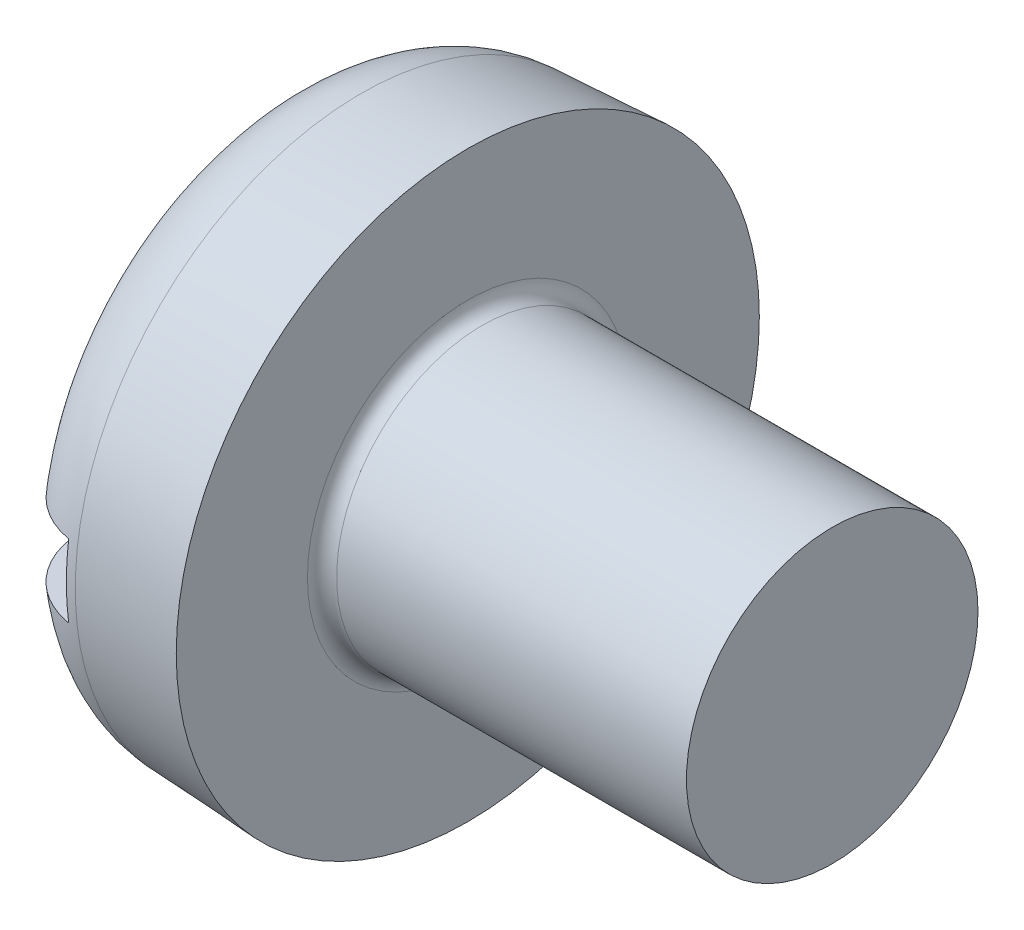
SolidWorks part; units mm, degrees
ref_plane "Front" through (0, 0, 0) normal (0, 0, 1) x (1, 0, 0)
ref_plane "Top" through (0, 0, 0) normal (0, 1, 0) x (1, 0, 0)
ref_plane "Right" through (0, 0, 0) normal (1, 0, 0) x (0, 0, -1)
ref_plane "Plane1" through (1.3, 0, 0) normal (1, 0, 0) x (0, 0, -1)
sketch "Sketch1" plane through (1.3, 0, 0) normal (1, 0, 0) x (0, 0, -1)
  circle A0 centre (0, 0) radius 2
  dimension "dk" = 4
extrude "BaseHead" add sketch "Sketch1" against normal blind 1.3 draft 3
sketch "Sketch2" plane through (1.3, 0, 0) normal (1, 0, 0) x (0, 0, -1)
  line L0 (0, 0) -> (0.8, 0) construction
  circle A0 centre (0, 0) radius 1
  dimension "d" = 2
  dimension "a" = 0.8
extrude "BaseBody" add sketch "Sketch2" along normal blind 2.5
fillet "HeadFillet2" radius 0.6 1 edges at (0, 0, -1.9319)
sketch "Sketch3" plane through (1.05, -1.05, 0) normal (0, 0, 1) x (0, -1, 0)
  line L1 (-1.3, -0.55) -> (-0.8, -0.55)
  line L2 (-1.3, -0.55) -> (-1.3, -1.05)
  line L3 (-1.3, -1.05) -> (-0.8, -1.05)
  line L4 (-0.8, -0.55) -> (-0.8, -1.05)
  line L5 (-2.4125, -1.05) -> (0.3125, -1.05) construction
  dimension "n" = 0.5
  dimension "m" = 0.25
  dimension "t" = 0.5
extrude "Notch" cut sketch "Sketch3" against normal through all and the other way through all
fillet "HeadFillet1" radius 0.1 1 edges at (1.3, 0, -1)
sketch "Sketch4" plane through (0, 0, 0) normal (0, 0, 1) x (1, 0, 0)
  line L0 (-34.7, 5.7835) -> (-34.7, 1)
  line L1 (1.3, 5.7835) -> (-34.7, 5.7835)
  line L2 (1.3, 5.7835) -> (1.3, 0.7835)
  line L3 (1.3, 0.7835) -> (-37.9, 0.7835)
  line L6 (6.4188, 0) -> (-0.5067, 0) construction
  line L8 (3.8, -1) -> (3.8, 1) construction
  line L9 (-34.7, 1) -> (-37.9, 0.7835)
  line L11 (1.3, -2) -> (1.3, 2) construction
  line L12 (3.8, 1) -> (1.4, 1) construction
  dimension "dd" = 5
  dimension "b1" = 1.567
  dimension "b" = 38.5
  dimension "x" = 3.2
sketch "Sketch5" plane through (0, 0, 0) normal (0, 0, 1) x (1, 0, 0)
  line L0 (3.8, 0.8125) -> (3.9083, 1)
  line L1 (3.9083, 1) -> (3.9083, 1.2165)
  line L2 (3.9083, 1.2165) -> (3.6917, 1.2165)
  line L3 (3.6917, 1.2165) -> (3.6917, 1)
  line L4 (3.6917, 1) -> (3.8, 0.8125)
  line L5 (0, 0) -> (4.296, 0) construction
  line L6 (3.8, -1) -> (3.8, 1) construction
  dimension "D1" = 2
  dimension "D2" = 0.2165
revolve "Cut-Revolve10" [suppressed] cut sketch "Sketch5" angle 360 about L5
pattern_linear "LPattern10" [suppressed] count 7 spacing 0.2598 along (1, 0, 0)
equation "\"m@Sketch3\" = \"n@Sketch3\" / 2"
equation "\"D1@Plane1\" = \"k@BaseHead\""
equation "\"D1@Sketch5\" = \"d@Sketch2\""
equation "\"D2@Sketch5\" =  ( \"d@Sketch2\" - \"D2@ThreadCosmetic1\" )  / 2"
equation "\"D3@LPattern10\" = \"D2@Sketch5\" * 1.2"
equation "\"D1@LPattern10\" = \"D1@ThreadCosmetic1\" / \"D3@LPattern10\" "
